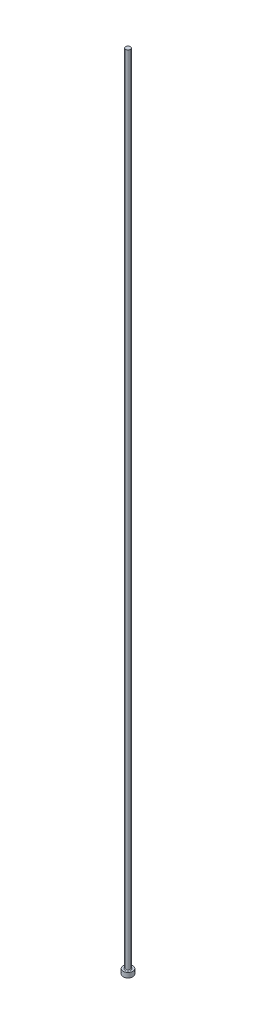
SolidWorks part; units mm, degrees
ref_plane "Plano frontal" through (0, 0, 0) normal (0, 0, 1) x (1, 0, 0)
ref_plane "Plano superior" through (0, 0, 0) normal (0, 1, 0) x (1, 0, 0)
ref_plane "Plano direito" through (0, 0, 0) normal (1, 0, 0) x (0, 0, -1)
sketch "Esboço1" plane through (0, 0, 0) normal (0, 0, 1) x (1, 0, 0)
  line L0 (0, 0) -> (1.5, 0)
  line L1 (1.5, 0) -> (1.5, 1.5)
  line L2 (1.5, 1.5) -> (0.95, 1.5)
  line L3 (0.75, 1.7) -> (0.75, 250)
  line L4 (0.75, 250) -> (0, 250)
  line L5 (0, 250) -> (0, 0) construction
  line L6 (0, 0) -> (0, 250)
  arc A0 (0.95, 1.5) -> (0.75, 1.7) centre (0.95, 1.7) cw
  dimension "D3" = 0.2
  dimension "D1" = 3
  dimension "D2" = 1.5
  dimension "D4" = 1.5
  dimension "D5" = 250
revolve "Revolução1" add sketch "Esboço1" angle 360 about L5
sketch "Esboço2"
  dimension "D1" = 0.1125
  dimension "D2" = 0.2625
  dimension "D3" = 0.1687
  dimension "D4" = 0.8063
wrap "Envolver1" sketch "Esboço2" wrap type deboss source sketch "Esboço2" thickness 0.1 parameters "D1"=0.1
